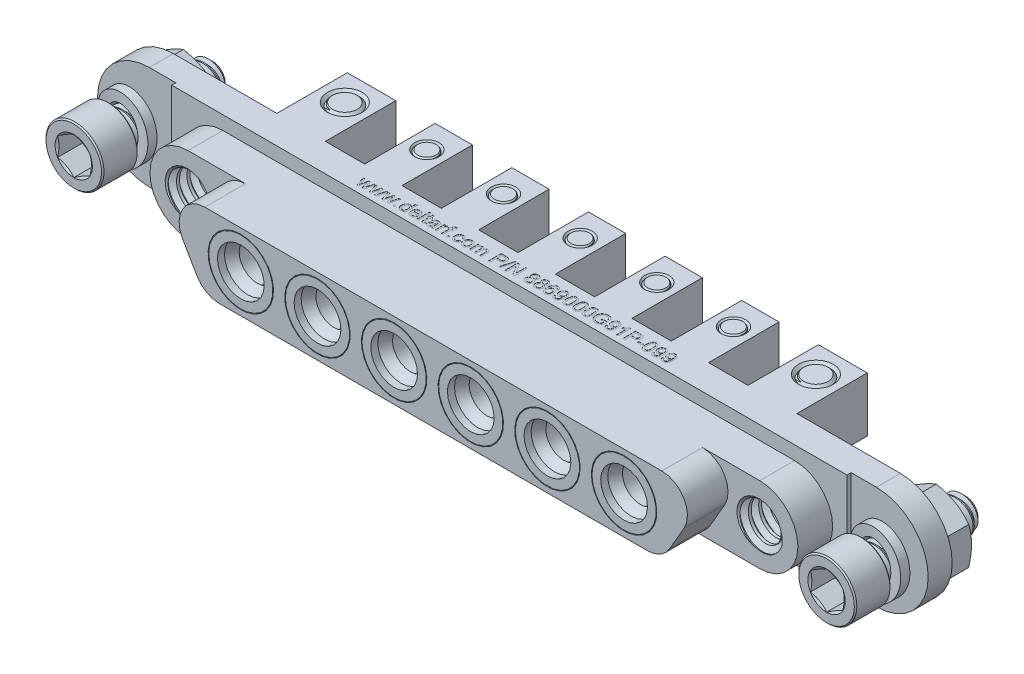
SolidWorks part; units mm, degrees
ref_plane "Front Plane" through (0, 0, 0) normal (0, 0, 1) x (1, 0, 0)
ref_plane "Top Plane" through (0, 0, 0) normal (0, 1, 0) x (1, 0, 0)
ref_plane "Right Plane" through (0, 0, 0) normal (1, 0, 0) x (0, 0, -1)
imported_body "21-197-1-solid1"
imported_body "57-485-1-solid1"
imported_body "44-1544-1-solid1"
imported_body "53-71(1)-1-solid1"
imported_body "81-466-9-solid1"
imported_body "57-485-9-solid1"
imported_body "57-485-10-solid1"
imported_body "44-1544-9-solid1"
imported_body "44-1544-10-solid1"
imported_body "81-466-10-solid1"
imported_body "81-466-11-solid1"
imported_body "68-38-1-solid1"
imported_body "68-38-2-solid1"
imported_body "68-39-1-solid1"
imported_body "68-38-5-solid1"
imported_body "28-123-1-solid1"
imported_body "52-51-1-solid1"
imported_body "68-38-6-solid1"
imported_body "28-123-2-solid1"
imported_body "52-51-2-solid1"
imported_body "68-39-2-solid1"
imported_body "57-485-11-solid1"
imported_body "44-1544-11-solid1"
imported_body "81-466-12-solid1"
imported_body "68-39-3-solid1"
imported_body "81-466-13-solid1"
imported_body "44-1544-12-solid1"
imported_body "57-485-12-solid1"
imported_body "68-39-4-solid1"
imported_body "57-485-13-solid1"
imported_body "44-1544-13-solid1"
imported_body "81-466-14-solid1"
imported_body "68-39-5-solid1"
sketch "Sketch1" plane through (0, 0, 3.5052) normal (0, 0, 1) x (1, 0, 0)
  line L1 (-13.8796, 2.0816) -> (13.5776, 2.0816)
  line L2 (-13.8796, 2.0816) -> (-13.8796, -1.9889)
  line L3 (-13.8796, -1.9889) -> (13.5776, -1.9889)
  line L4 (13.5776, 2.0816) -> (13.5776, -1.9889)
extrude "Boss-Extrude1" add sketch "Sketch1" against normal up to surface (4.2418 mm away)
sketch "Sketch2" plane through (0, 3.175, 0) normal (0, 1, 0) x (1, 0, 0)
  line L0 (-13.1176, -0.6017) -> (14.6057, -0.6017) construction
  text T0 "           www.deltarf.com P/N 8869000G91P-099" height in points 3
extrude "Cut-Extrude1" cut sketch "Sketch2" against normal blind 0.0102
